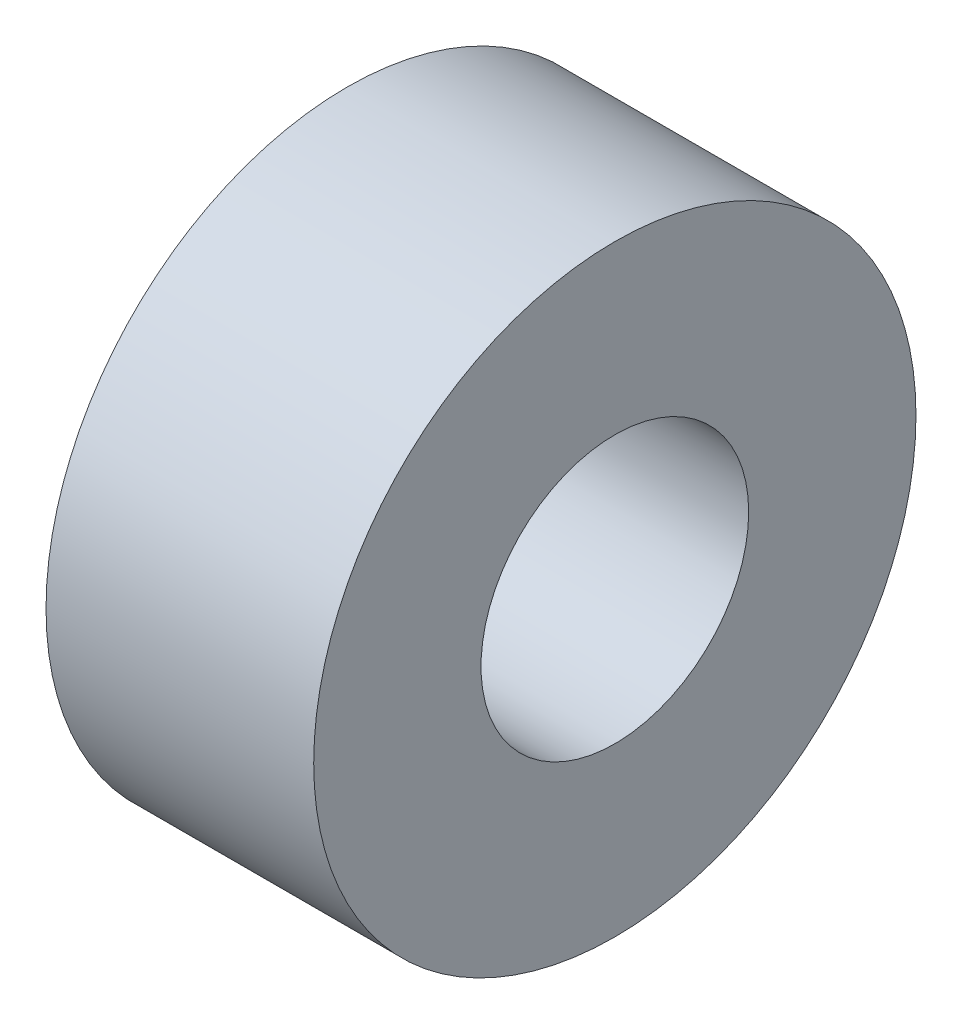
SolidWorks part; units mm, degrees
ref_plane "Plano frontal" through (0, 0, 0) normal (0, 0, 1) x (1, 0, 0)
ref_plane "Plano superior" through (0, 0, 0) normal (0, 1, 0) x (1, 0, 0)
ref_plane "Plano direito" through (0, 0, 0) normal (1, 0, 0) x (0, 0, -1)
sketch "Esboço1" plane through (0, 0, 0) normal (1, 0, 0) x (0, 0, -1)
  circle A0 centre (0, 0) radius 4.5
  circle A1 centre (0, 0) radius 2
  dimension "D1" = 9
  dimension "D2" = 4
extrude "Ressalto-extrusão1" add sketch "Esboço1" along normal blind 4
